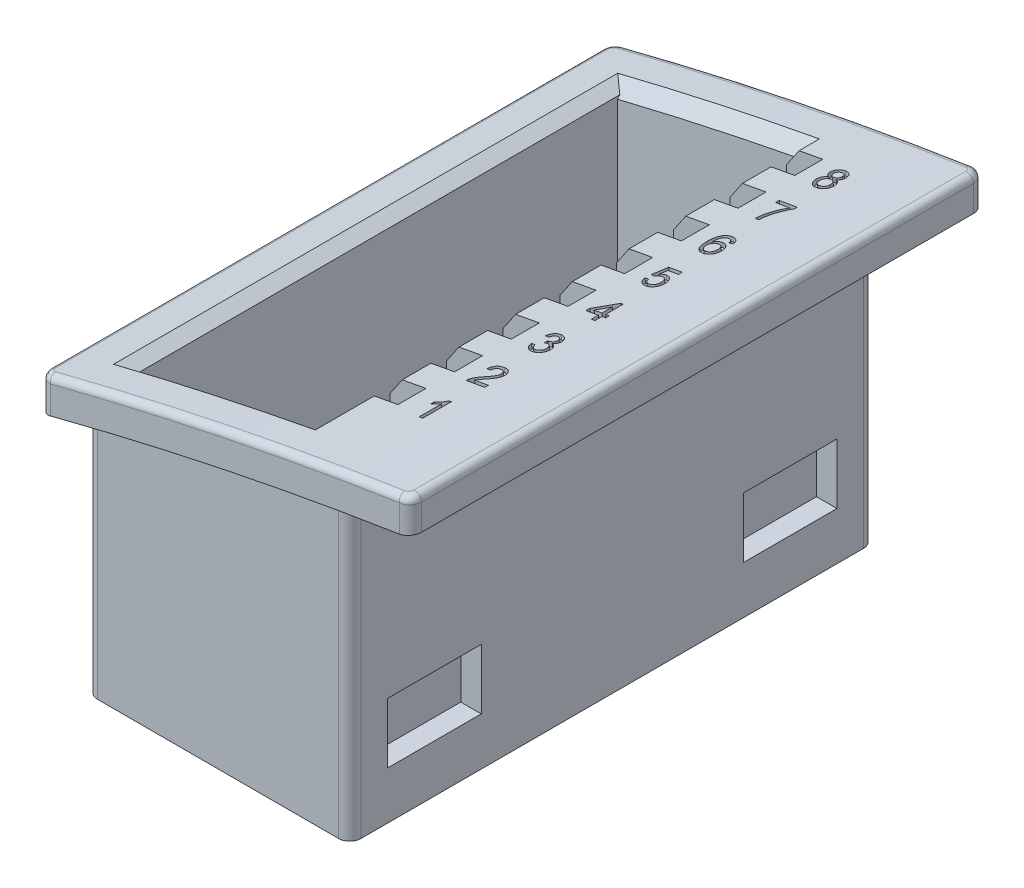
SolidWorks part; units mm, degrees
ref_plane "Front Plane" through (0, 0, 0) normal (0, 0, 1) x (1, 0, 0)
ref_plane "Top Plane" through (0, 0, 0) normal (0, 1, 0) x (1, 0, 0)
ref_plane "Right Plane" through (0, 0, 0) normal (1, 0, 0) x (0, 0, -1)
sketch "Sketch1" plane through (0, 0, 0) normal (0, 0, 1) x (1, 0, 0)
  line L0 (9.7211, 14.3502) -> (9.7193, 15.867)
  line L1 (-6.9049, 10.9118) -> (-6.9049, 12.4622)
  line L2 (6.8, 0) -> (-6.8, 0) construction
  line L3 (1.3625, 12.8514) -> (1.3625, 14.3829) construction
  arc A0 (9.7211, 14.3502) -> (-6.9049, 10.9118) centre (33.7964, -143.9799) ccw
  arc A3 (9.7193, 15.867) -> (-6.9049, 12.4622) centre (33.7964, -143.9799) ccw
  dimension "D1" = 160.15
  dimension "D3" = 161.65
  dimension "D2" = 12.8514
  dimension "D4" = 1.5168
  dimension "D5" = 1.5504
  dimension "D6" = 1.3625
extrude "Extrude1" add sketch "Sketch1" along normal mid plane 25.72
sketch "Sketch2" plane through (0, 0, 0) normal (0, 1, 0) x (1, 0, 0)
  line L0 (-5.9, -11.76) -> (5.9, -11.76)
  line L1 (5.9, 11.76) -> (5.9, -11.76)
  line L2 (5.9, 11.76) -> (-5.9, 11.76)
  line L3 (-5.9, 11.76) -> (-5.9, -11.76)
  line L4 (-5.9, 0) -> (5.9, 0) construction
  dimension "D1" = 11.8
  dimension "D2" = 23.52
extrude "Extrude2" add sketch "Sketch2" along normal up to surface (13.7218 mm away)
sketch "Sketch3" plane through (0, 0, 11.76) normal (0, 0, 1) x (1, 0, 0)
  line L0 (-5.9, 10.9118) -> (-6.9049, 10.9118)
  line L1 (-5.9, 11.1724) -> (-5.9, 0) construction
  line L2 (-5.9, 10.9118) -> (-5.9, 11.3118)
  line L3 (-5.9, 11.3118) -> (-6.9049, 10.9118)
  dimension "D1" = 0.4
extrude "Extrude4" add sketch "Sketch3" against normal up to surface (23.52 mm away)
sketch "Sketch4" plane through (0, 0, 0) normal (0, -1, 0) x (1, 0, 0)
  line L0 (3.35, -10.71) -> (-4.5827, -10.71)
  line L1 (3.35, -10.71) -> (3.35, 10.7427)
  line L2 (3.35, 10.7427) -> (-4.5827, 10.7427)
  line L3 (-4.5827, -10.71) -> (-4.5827, 10.7427)
  line L4 (-5.9, -11.76) -> (-5.9, 11.76) construction
  line L5 (-5.9, 11.76) -> (5.9, 11.76) construction
  dimension "D1" = 7.9327
  dimension "D2" = 21.4527
  dimension "D3" = 1.3173
  dimension "D4" = 1.0173
extrude "Cut-Extrude1" cut sketch "Sketch4" against normal up to surface (13.048 mm away)
fillet "Fillet1" radius 0.5 4 edges at (5.9, 6.8609, -11.76) (-5.9, 5.4559, -11.76) (-5.9, 5.4559, 11.76) (5.9, 6.8609, 11.76)
fillet "Fillet2" radius 0.5 4 edges at (9.7202, 15.1086, -12.86) (-6.9049, 11.687, -12.86) (-6.9049, 11.687, 12.86) (9.7202, 15.1086, 12.86)
fillet "Fillet3" radius 0.3 8 edges at (9.5344, 15.839, 12.7483) (9.7193, 15.867, 0) (9.6119, 15.8508, -12.6698) (1.3678, 14.384, -12.86) (-6.7251, 12.5089, -12.744) (-6.9049, 12.4622, 0) (-6.8013, 12.4891, 12.6648) (1.3678, 14.384, 12.86)
chamfer "Chamfer1" distance 0.5673 angle 45 4 edges at (-4.5827, 13.048, 0.0164) (-0.6272, 13.9623, 10.7427) (3.35, 14.777, 0.0164) (-0.6272, 13.9623, -10.71)
sketch "Sketch5" plane through (0, 0, -11.76) normal (0, 0, -1) x (-1, 0, 0)
  line L0 (4.5827, 12.464) -> (4.5827, 0) construction
  line L1 (-3.35, 4.5) -> (4.5827, 4.5)
  line L2 (4.5827, 4.5) -> (4.5827, 0)
  line L4 (-5.4, 0) -> (5.4, 0) construction
  line L5 (4.5827, 0) -> (-3.35, 0)
  line L6 (-3.35, 14.0623) -> (-3.35, 0) construction
  line L7 (-3.35, 4.5) -> (-3.35, 0)
  dimension "D1" = 4.5
extrude "Cut-Extrude2" cut sketch "Sketch5" against normal up to surface (1.05 mm away)
sketch "Sketch6" plane through (-5.9, 0, 0) normal (-1, 0, 0) x (0, 0, 1)
  line L0 (-3.5, 4.8417) -> (3.5, 4.8417)
  line L1 (-3.5, 2.1416) -> (-3.5, 4.8417)
  line L2 (-3.5, 2.1416) -> (3.5, 2.1416)
  line L3 (3.5, 4.8417) -> (3.5, 2.1416)
  line L4 (0, 2.1416) -> (0, 0) construction
  line L7 (-11.26, 0) -> (11.26, 0) construction
  dimension "D1" = 2.1416
  dimension "D2" = 7
  dimension "D3" = 2.7001
extrude "Cut-Extrude3" cut sketch "Sketch6" against normal blind 0.9687
sketch "Sketch7" plane through (5.9, 0, 0) normal (1, 0, 0) x (0, 0, -1)
  line L0 (10.0694, 4.8422) -> (10.0694, 2.1421)
  line L1 (5.8694, 4.8422) -> (10.0694, 4.8422)
  line L2 (5.8694, 2.1421) -> (10.0694, 2.1421)
  line L3 (5.8694, 2.1421) -> (5.8694, 4.8422)
  line L4 (10.0694, 3.4921) -> (11.76, 3.4921) construction
  line L5 (7.9694, 2.1421) -> (7.9694, 0) construction
  line L6 (0, 0) -> (0, 13.7218) construction
  line L7 (-11.26, 0) -> (11.26, 0) construction
  line L8 (11.76, 13.6325) -> (11.76, 0) construction
  line L9 (-11.26, 13.7218) -> (11.26, 13.7218) construction
  line L10 (-7.9694, 2.1421) -> (-7.9694, 0) construction
  line L11 (-10.0694, 3.4921) -> (-11.76, 3.4921) construction
  line L12 (-5.8694, 2.1421) -> (-5.8694, 4.8422)
  line L13 (-5.8694, 2.1421) -> (-10.0694, 2.1421)
  line L14 (-5.8694, 4.8422) -> (-10.0694, 4.8422)
  line L15 (-10.0694, 4.8422) -> (-10.0694, 2.1421)
  dimension "D1" = 4.2
  dimension "D2" = 2.7001
  dimension "D3" = 2.1421
  dimension "D4" = 1.6906
extrude "Cut-Extrude4" cut sketch "Sketch7" against normal blind 0.9187
sketch "Sketch8" plane through (0, 0, 0) normal (0, -1, 0) x (1, 0, 0)
  line L0 (4.6814, 8.6714) -> (3.35, 8.6714)
  line L1 (3.35, 7.4152) -> (4.6814, 7.4152)
  line L2 (4.6814, 8.6714) -> (4.6814, 7.4152)
  line L3 (-5.4, 11.76) -> (5.4, 11.76) construction
  line L4 (5.9, 11.26) -> (5.9, -11.26) construction
  line L5 (4.6814, 8.6714) -> (4.6814, 11.76) construction
  line L6 (4.6814, 8.0433) -> (5.9, 8.0433) construction
  line L7 (3.35, 8.6714) -> (3.35, 7.4152)
  line L8 (3.35, -11.76) -> (3.35, 10.7427) construction
  dimension "D1" = 1.2186
  dimension "D2" = 3.0886
  dimension "D3" = 1.2562
chamfer "Chamfer2" distance 0.5673 angle 45 3 edges at (3.35, 0, -0.5087) (-0.6164, 0, 10.7427) (-4.5827, 0, -0.5087)
extrude "Cut-Extrude6" cut sketch "Sketch8" against normal up to surface (15.0265 mm away)
pattern_linear "LPattern1" count 8 spacing 2.54 along (0, 0, -1) of "Cut-Extrude6"
sketch "Sketch9" plane through (0, 0, 12.86) normal (0, 0, 1) x (1, 0, 0)
  arc A0 (-6.4049, 12.5914) -> (9.2194, 15.7909) centre (33.7964, -143.9799) ccw construction
  point P0 (7.0615, 15.444)
ref_plane "Plane1" through (7.0615, 15.444, 12.56) normal (-0.1654, 0.9862, 0) x (-0.9862, -0.1654, 0)
sketch "Sketch10"
  dimension "D1" = 17.8106
extrude "Cut-Extrude7" cut sketch "Sketch10" against normal blind 0.2
chamfer "Chamfer3" distance 0.2904 angle 45 8 edges at (4.6814, 15.0265, 8.0433) (4.6814, 15.0265, 5.5033) (4.6814, 15.0265, 2.9633) (4.6814, 15.0265, 0.4233) (4.6814, 15.0265, -2.1167) (4.6814, 15.0265, -4.6567) (4.6814, 15.0265, -7.1967) (4.6814, 15.0265, -9.7367)
